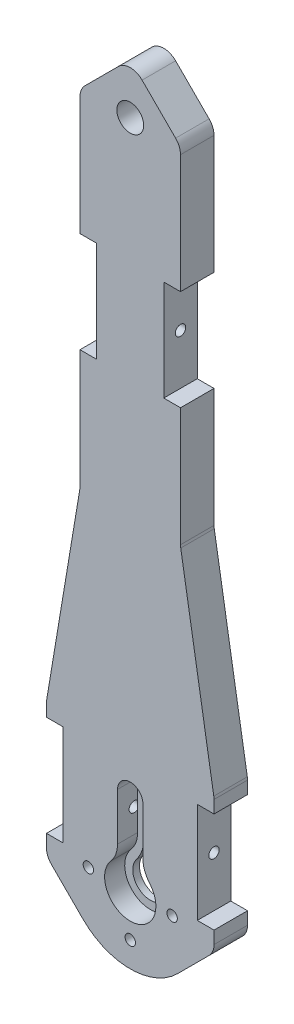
SolidWorks part; units mm, degrees
ref_plane "Alzado" through (0, 0, 0) normal (0, 0, 1) x (1, 0, 0)
ref_plane "Planta" through (0, 0, 0) normal (0, 1, 0) x (1, 0, 0)
ref_plane "Vista lateral" through (0, 0, 0) normal (1, 0, 0) x (0, 0, -1)
sketch "Croquis1" plane through (0, 0, 0) normal (0, 0, 1) x (1, 0, 0)
  line L0 (0, 0) -> (0, 200) construction
  line L1 (-14.1421, -14.1421) -> (-25, -3.2843)
  line L2 (14.1421, -14.1421) -> (25, -3.2843)
  line L8 (-1.4406, -20) -> (49998.5594, -20) construction
  line L14 (-25, -3.2843) -> (-25, 36.7157)
  line L15 (-25, 36.7157) -> (-15, 96.7157)
  line L16 (-15, 96.7157) -> (-15, 200)
  line L20 (-3.8, 10.35) -> (-3.8, 24.5)
  line L21 (3.8, 24.5) -> (3.8, 10.35)
  line L23 (-15, 200) -> (0, 215)
  line L24 (0, 215) -> (15, 200)
  line L25 (15, 96.7157) -> (15, 200)
  line L26 (25, -3.2843) -> (25, 36.7157)
  line L27 (25, 36.7157) -> (15, 96.7157)
  circle A1 centre (0, 200) radius 4
  arc A2 (6.6178, -9.8987) -> (9.5257, 7.1443) centre (0, 0) ccw construction
  arc A11 (0, 11.9071) -> (-9.5257, 7.1443) centre (0, 0) ccw construction
  arc A12 (9.5257, 7.1443) -> (0, 11.9071) centre (0, 0) ccw construction
  arc A13 (-14.1421, -14.1421) -> (14.1421, -14.1421) centre (0, 0) ccw
  arc A15 (0, 28.3) -> (-3.8, 24.5) centre (0, 24.5) ccw
  arc A16 (3.8, 24.5) -> (0, 28.3) centre (0, 24.5) ccw
  arc A17 (3.8, 10.35) -> (5.8, 4.35) centre (13.8, 10.35) ccw
  arc A18 (-5.8, 4.35) -> (-3.8, 10.35) centre (-13.8, 10.35) ccw
  arc A19 (0, -7.25) -> (5.8, 4.35) centre (0, 0) ccw
  arc A20 (-5.8, 4.35) -> (0, -7.25) centre (0, 0) ccw
  point P21 (0, -20)
  dimension "D1" = 20
  dimension "D2" = 200
  dimension "D8" = 11.9071
  dimension "D9" = 15
  dimension "D5" = 8
  dimension "D3" = 45
  dimension "D4" = 25
  dimension "D6" = 40
  dimension "D7" = 60
  dimension "D12" = 235
extrude "Saliente-Extruir1" add sketch "Croquis1" along normal blind 10 contours L1 A13 L2
sketch "Croquis2" plane through (0, 0, 0) normal (0, 0, 1) x (1, 0, 0)
  line L0 (3.8, 10.35) -> (3.8, 24.5) construction
  line L1 (-3.8, 24.5) -> (-3.8, 10.35) construction
  line L2 (3.8, 10.35) -> (3.8, 24.5)
  line L3 (-3.8, 24.5) -> (-3.8, 10.35)
  arc A6 (1.8, 10.35) -> (-1.8, 10.35) centre (0, 10.35) ccw
  arc A7 (3.8, 24.5) -> (-3.8, 24.5) centre (0, 24.5) ccw construction
  arc A8 (-5.8, 4.35) -> (-3.8, 10.35) centre (-13.8, 10.35) ccw construction
  arc A9 (-4.2, 3.15) -> (-1.8, 10.35) centre (-13.8, 10.35) ccw
  arc A10 (1.8, 10.35) -> (4.2, 3.15) centre (13.8, 10.35) ccw
  arc A11 (-4.2, 3.15) -> (4.2, 3.15) centre (0, 0) ccw
  arc A12 (-4.2, 3.15) -> (-1.8, 10.35) centre (-13.8, 10.35) ccw
  arc A13 (1.8, 10.35) -> (4.2, 3.15) centre (13.8, 10.35) ccw
  arc A14 (-4.2, 3.15) -> (4.2, 3.15) centre (0, 0) ccw
  arc A15 (-5.8, 4.35) -> (5.8, 4.35) centre (0, 0) ccw construction
  arc A16 (3.8, 10.35) -> (5.8, 4.35) centre (13.8, 10.35) ccw construction
  arc A17 (3.8, 24.5) -> (-3.8, 24.5) centre (0, 24.5) ccw
  arc A18 (-5.8, 4.35) -> (-3.8, 10.35) centre (-13.8, 10.35) ccw
  arc A19 (-5.8, 4.35) -> (5.8, 4.35) centre (0, 0) ccw
  arc A20 (3.8, 10.35) -> (5.8, 4.35) centre (13.8, 10.35) ccw
  circle A21 centre (0, 24.5) radius 1.55
  circle A22 centre (0, 20.5) radius 1.55
  dimension "D3" = 3.1
  dimension "D2" = 4
  dimension "D1" = 2
extrude "Saliente-Extruir2" add sketch "Croquis2" along normal blind 4
sketch "Croquis3" plane through (0, 0, 0) normal (0, 0, -1) x (-1, 0, 0)
  circle A6 centre (0, 0) radius 5.25
  circle A7 centre (0, 0) radius 15
  dimension "D1" = 10.5
  dimension "D2" = 30
extrude "Cortar-Extruir1" cut sketch "Croquis3" against normal blind 2
sketch "Croquis4" plane through (0, 0, 2) normal (0, 0, -1) x (-1, 0, 0)
  circle A0 centre (0, 0) radius 12.5 construction
  circle A1 centre (-12.5, 0) radius 1.55
  circle A2 centre (0, -12.5) radius 1.55
  circle A3 centre (12.5, 0) radius 1.55
  dimension "D1" = 3.1
  dimension "D2" = 25
extrude "Cortar-Extruir2" cut sketch "Croquis4" against normal through all
fillet "Redondeo2" radius 5 9 edges at (-15, 96.7157, 5) (-25, 36.7157, 5) (-25, -3.2843, 5) (-15, 200, 5) (0, 215, 5) (25, -3.2843, 5) (25, 36.7157, 5) (15, 96.7157, 5) (15, 200, 5)
sketch "Croquis6" plane through (-25, 0, 0) normal (-1, 0, 0) x (0, 0, 1)
  line L0 (0, 32.5444) -> (10, 22.5444) construction
  line L1 (0, 36.3019) -> (0, -1.2132) construction
  line L2 (10, 36.3019) -> (10, -1.2132) construction
  line L3 (10, 22.5444) -> (10, 12.5444)
  line L4 (10, 12.5444) -> (0, 2.5444) construction
  line L5 (0, 2.5444) -> (0, 32.5444)
  line L6 (0, 36.3019) -> (0, -1.2132) construction
  line L7 (0, 17.5444) -> (10, 17.5444) construction
  line L9 (0, 32.5444) -> (10, 32.5444)
  line L10 (0, 32.5444) -> (0, 2.5444)
  line L11 (0, 2.5444) -> (10, 2.5444)
  line L12 (10, 32.5444) -> (10, 2.5444)
  dimension "D1" = 45
  dimension "D2" = 30
extrude "Cortar-Extruir4" cut sketch "Croquis6" against normal blind 5 contours L11 L9 M8 M6
sketch "Croquis7" plane through (-15, 0, 0) normal (-1, 0, 0) x (0, 0, 1)
  line L0 (0, 197.9289) -> (0, 97.1295) construction
  line L1 (0, 197.9289) -> (0, 97.1295) construction
  line L2 (10, 152.5292) -> (10, 142.5292)
  line L3 (10, 197.9289) -> (10, 97.1295) construction
  line L4 (0, 147.5292) -> (10, 147.5292) construction
  line L5 (10, 142.5292) -> (0, 132.5292) construction
  line L6 (10, 152.5292) -> (0, 162.5292) construction
  line L7 (0, 162.5292) -> (0, 132.5292)
  line L8 (10, 197.9289) -> (10, 97.1295) construction
  line L9 (0, 162.5292) -> (10, 162.5292)
  line L10 (0, 162.5292) -> (0, 132.5292)
  line L11 (0, 132.5292) -> (10, 132.5292)
  line L12 (10, 162.5292) -> (10, 132.5292)
  dimension "D1" = 30
  dimension "D2" = 45
extrude "Cortar-Extruir5" cut sketch "Croquis7" against normal blind 5 contours L11 L9 M6 M8
sketch "Croquis8" plane through (15, 0, 0) normal (1, 0, 0) x (0, 0, -1)
  line L15 (0, 162.5292) -> (0, 132.5292) construction
  line L16 (0, 132.5292) -> (-10, 132.5292) construction
  line L17 (-10, 132.5292) -> (-10, 162.5292) construction
  line L18 (-10, 162.5292) -> (0, 162.5292) construction
  line L23 (0, 162.5292) -> (0, 132.5292)
  line L24 (0, 132.5292) -> (-10, 132.5292)
  line L25 (-10, 132.5292) -> (-10, 162.5292)
  line L26 (-10, 162.5292) -> (0, 162.5292)
extrude "Cortar-Extruir6" cut sketch "Croquis8" against normal blind 5
sketch "Croquis9" plane through (-10, 0, 0) normal (-1, 0, 0) x (0, 0, 1)
  line L0 (5, 132.5292) -> (5, 162.5292) construction
  line L5 (0, 132.5292) -> (10, 132.5292) construction
  line L6 (0, 162.5292) -> (10, 162.5292) construction
  circle A1 centre (5, 147.5292) radius 1.55
  dimension "D1" = 3.1
sketch "Croquis10" plane through (-20, 0, 0) normal (-1, 0, 0) x (0, 0, 1)
  line L0 (5, 36.3019) -> (5, -1.2132) construction
  line L3 (0, -1.2132) -> (10, -1.2132) construction
  line L4 (10, 36.3019) -> (0, 36.3019) construction
  circle A0 centre (5, 17.5444) radius 1.55
  dimension "D1" = 3.1
extrude "Cortar-Extruir8" cut sketch "Croquis10" against normal up to surface (16.2 mm away)
sketch "Croquis12" plane through (0, 0, 10) normal (0, 0, 1) x (1, 0, 0)
  line L0 (-3.8, 10.35) -> (3.8, 10.35)
  arc A0 (-5.7903, 4.9995) -> (5.7903, 4.9995) centre (0, 0) ccw
  arc A1 (-5.8, 4.35) -> (5.8, 4.35) centre (0, 0) ccw construction
  arc A2 (-3.8, 10.35) -> (-5.7903, 4.9995) centre (-11.987, 10.35) cw
  arc A3 (3.8, 10.35) -> (5.7903, 4.9995) centre (11.987, 10.35) ccw
  arc A4 (3.8, 10.35) -> (5.8, 4.35) centre (13.8, 10.35) ccw construction
  arc A5 (-5.8, 4.35) -> (-3.8, 10.35) centre (-13.8, 10.35) ccw construction
  arc A6 (3.8, 10.35) -> (4.8278, 5.9342) centre (13.8, 10.35) ccw construction
  arc A7 (-5.8, 4.35) -> (-3.8, 10.35) centre (-13.8, 10.35) ccw construction
  arc A8 (4.8278, 5.9342) -> (-4.8278, 5.9342) centre (0, 0) ccw construction
  arc A9 (-4.8278, 5.9342) -> (-5.7903, 4.9995) centre (0, 0) ccw construction
  arc A10 (4.8278, 5.9342) -> (5.8, 4.35) centre (13.8, 10.35) ccw construction
  arc A11 (5.7903, 4.9995) -> (4.8278, 5.9342) centre (0, 0) ccw construction
  dimension "D1" = 0.4
extrude "Cortar-Extruir10" cut sketch "Croquis12" against normal up to surface (6 mm away)
extrude "Cortar-Extruir11" cut sketch "Croquis9" against normal through all
sketch "Croquis13" plane through (25, 0, 0) normal (1, 0, 0) x (0, 0, -1)
  line L4 (0, 2.5444) -> (0, 32.5444)
  line L5 (-10, 2.5444) -> (0, 2.5444)
  line L6 (-10, 32.5444) -> (-10, 2.5444)
  line L7 (0, 32.5444) -> (-10, 32.5444)
  line L8 (0, 2.5444) -> (0, 32.5444)
  line L9 (-10, 2.5444) -> (0, 2.5444)
  line L10 (-10, 32.5444) -> (-10, 2.5444)
  line L11 (0, 32.5444) -> (-10, 32.5444)
  dimension "D1" = 0
extrude "Cortar-Extruir12" cut sketch "Croquis13" against normal blind 5
sketch "Croquis15" plane through (20, 0, 0) normal (1, 0, 0) x (0, 0, -1)
  circle A0 centre (-5, 17.5444) radius 1.55 construction
  circle A1 centre (-5, 17.5444) radius 1.55
extrude "Cortar-Extruir13" cut sketch "Croquis15" against normal up to surface (16.2 mm away)
sketch "Croquis16" plane through (0, 0, 2) normal (0, 0, -1) x (-1, 0, 0)
  circle A0 centre (0, 0) radius 15 construction
  circle A1 centre (12.5, 0) radius 1.55
  circle A2 centre (12.5, 0) radius 1.55
  circle A3 centre (0, -12.5) radius 1.55
  circle A4 centre (0, -12.5) radius 1.55
  circle A5 centre (-12.5, 0) radius 1.55
  arc A6 (1.8, 10.35) -> (-1.8, 10.35) centre (0, 10.35) ccw
  arc A7 (1.8, 10.35) -> (4.2, 3.15) centre (13.8, 10.35) ccw
  arc A8 (-4.2, 3.15) -> (4.2, 3.15) centre (0, 0) ccw
  arc A9 (-4.2, 3.15) -> (-1.8, 10.35) centre (-13.8, 10.35) ccw
  arc A10 (1.8, 10.35) -> (-1.8, 10.35) centre (0, 10.35) ccw
  arc A11 (1.8, 10.35) -> (4.2, 3.15) centre (13.8, 10.35) ccw
  arc A12 (-4.2, 3.15) -> (4.2, 3.15) centre (0, 0) ccw
  arc A13 (-4.2, 3.15) -> (-1.8, 10.35) centre (-13.8, 10.35) ccw
  circle A14 centre (-12.5, 0) radius 1.55
  circle A15 centre (0, 0) radius 15
  dimension "D1" = 0
  dimension "D2" = 0
  dimension "D3" = 0
  dimension "D4" = 0
extrude "Saliente-Extruir3" add sketch "Croquis16" against normal blind 0.5
